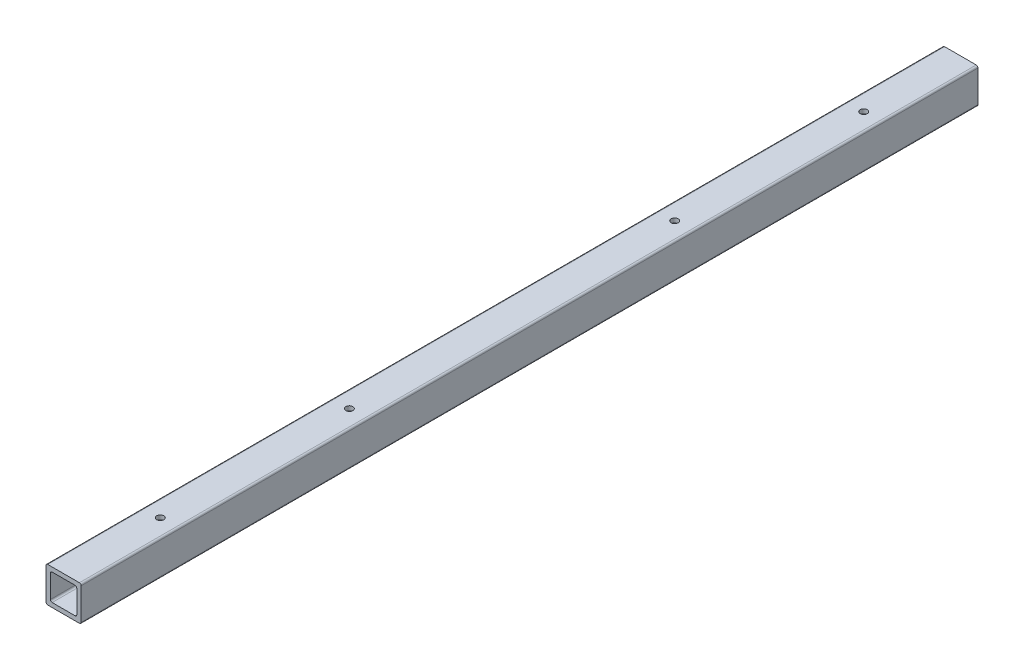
SolidWorks part; units mm, degrees
ref_plane "Front Plane" through (0, 0, 0) normal (0, 0, 1) x (1, 0, 0)
ref_plane "Top Plane" through (0, 0, 0) normal (0, 1, 0) x (1, 0, 0)
ref_plane "Right Plane" through (0, 0, 0) normal (1, 0, 0) x (0, 0, -1)
sketch "Sketch1" plane through (0, 0, 0) normal (0, 0, 1) x (1, 0, 0)
  line L1 (-22.86, -25.4) -> (22.86, -25.4)
  line L2 (-25.4, -22.86) -> (-25.4, 22.86)
  line L3 (-22.86, 25.4) -> (22.86, 25.4)
  line L4 (25.4, -22.86) -> (25.4, 22.86)
  line L5 (-16.51, -19.05) -> (16.51, -19.05)
  line L6 (-19.05, -16.51) -> (-19.05, 16.51)
  line L7 (-16.51, 19.05) -> (16.51, 19.05)
  line L8 (19.05, -16.51) -> (19.05, 16.51)
  arc A0 (-25.4, 22.86) -> (-22.86, 25.4) centre (-22.86, 22.86) cw
  arc A1 (-22.86, -25.4) -> (-25.4, -22.86) centre (-22.86, -22.86) cw
  arc A2 (25.4, -22.86) -> (22.86, -25.4) centre (22.86, -22.86) cw
  arc A3 (22.86, 25.4) -> (25.4, 22.86) centre (22.86, 22.86) cw
  arc A4 (16.51, 19.05) -> (19.05, 16.51) centre (16.51, 16.51) cw
  arc A5 (-19.05, 16.51) -> (-16.51, 19.05) centre (-16.51, 16.51) cw
  arc A6 (-16.51, -19.05) -> (-19.05, -16.51) centre (-16.51, -16.51) cw
  arc A7 (19.05, -16.51) -> (16.51, -19.05) centre (16.51, -16.51) cw
  point P11 (-25.4, 25.4)
  point P16 (25.4, -25.4)
  point P19 (25.4, 25.4)
  point P24 (-19.05, 19.05)
  point P27 (-19.05, -19.05)
  point P30 (19.05, -19.05)
  dimension "D9" = 2.54
  dimension "D1" = 50.8
  dimension "D2" = 50.8
  dimension "D3" = 38.1
  dimension "D4" = 25.4
  dimension "D5" = 25.4
  dimension "D6" = 19.05
  dimension "D7" = 19.05
  dimension "D8" = 38.1
extrude "Extrude1" add sketch "Sketch1" along normal mid plane 1295.4
sketch "Sketch2" plane through (0, 25.4, 0) normal (0, 1, 0) x (-1, 0, 0)
  line L1 (-25.4, 647.7) -> (-25.4, -647.7) construction
  circle A0 centre (0, 234.95) radius 5.08
  circle A1 centre (0, -234.95) radius 5.08
  circle A2 centre (0, 508) radius 5.08
  circle A3 centre (0, -508) radius 5.08
  dimension "D1" = 10.16
  dimension "D2" = 234.95
  dimension "D3" = 234.95
  dimension "D4" = 508
  dimension "D5" = 508
  dimension "D6" = 25.4
extrude "Cut-Extrude1" cut sketch "Sketch2" against normal through all
